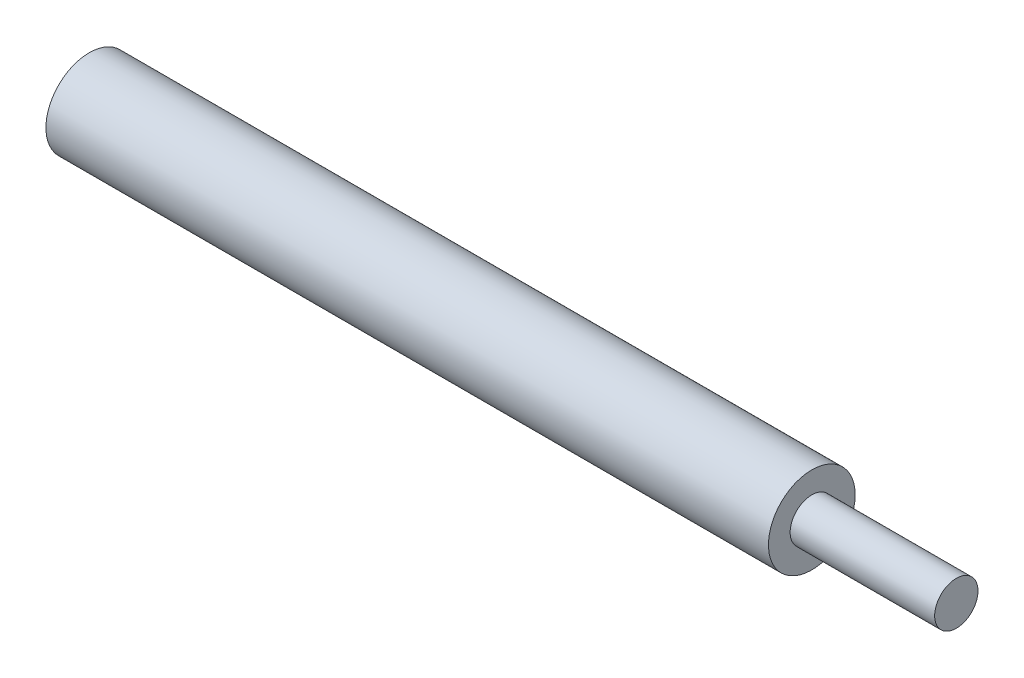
SolidWorks part; units mm, degrees
ref_plane "Plan de face" through (0, 0, 0) normal (0, 0, 1) x (1, 0, 0)
ref_plane "Plan de dessus" through (0, 0, 0) normal (0, 1, 0) x (1, 0, 0)
ref_plane "Plan de droite" through (0, 0, 0) normal (1, 0, 0) x (0, 0, -1)
sketch "Esquisse1" plane through (0, 0, 0) normal (1, 0, 0) x (0, 0, -1)
  circle A0 centre (0, 0) radius 3
  dimension "D1" = 6
extrude "Extrusion1" add sketch "Esquisse1" against normal blind 50
sketch "Esquisse2" plane through (0, 0, 0) normal (1, 0, 0) x (0, 0, -1)
  circle A0 centre (0, 0) radius 1.5
  dimension "D1" = 3
extrude "Extrusion2" add sketch "Esquisse2" along normal blind 10
